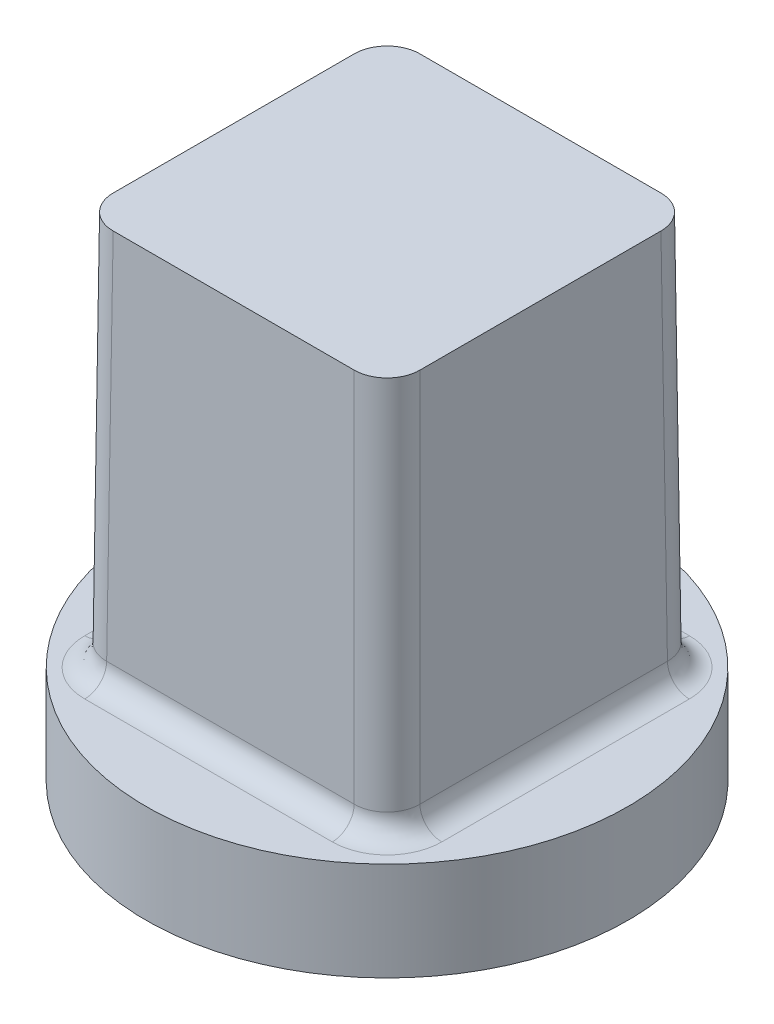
SolidWorks part; units mm, degrees
ref_plane "Płaszczyzna przednia" through (0, 0, 0) normal (0, 0, 1) x (1, 0, 0)
ref_plane "Płaszczyzna górna" through (0, 0, 0) normal (0, 1, 0) x (1, 0, 0)
ref_plane "Płaszczyzna prawa" through (0, 0, 0) normal (1, 0, 0) x (0, 0, -1)
imported_body "Import3"
ref_plane "Płaszczyzna1" through (0, 1.5, 0) normal (0, 1, 0) x (1, 0, 0)
sketch "Szkic1" plane through (0, 1.5, 0) normal (0, 1, 0) x (1, 0, 0)
  circle A0 centre (0, 0) radius 11
extrude "Dodanie-wyciągnięcie1" add sketch "Szkic1" against normal blind 4.5
sketch "Szkic2" plane through (0, -3, 0) normal (0, -1, 0) x (1, 0, 0)
  line L0 (2.1765, -9.2473) -> (0.7416, -5.1468)
  line L1 (0.7416, -5.1468) -> (2.6294, -4.4863)
  line L2 (2.6294, -4.4863) -> (4.0643, -8.5867)
  arc A0 (4.0643, -8.5867) -> (2.1765, -9.2473) centre (0, 0) ccw
draft "Pochylenie1" type of draft neutral plane draft angle 0.5 faces to draft 1 parameters "D1"=0.5
ref_plane "Płaszczyzna2" through (0, 0, 7.0698) normal (0, 0, 1) x (1, 0, 0)
ref_plane "Płaszczyzna3" through (0, 0, -7.0698) normal (0, 0, -1) x (-1, 0, 0)
fillet "Zaokrąglenie1" radius 1.5 4 edges at (-7.0785, 10.5, -7.0785) (-7.0785, 10.5, 7.0785) (7.0785, 10.5, 7.0785) (7.0785, 10.5, -7.0785)
fillet "Zaokrąglenie2" radius 1 8 edges at (6.7178, 1.5, 6.7178) (0, 1.5, 7.1571) (7.1571, 1.5, 0) (-6.7178, 1.5, 6.7178) (6.7178, 1.5, -6.7178) (-7.1571, 1.5, 0) (0, 1.5, -7.1571) (-6.7178, 1.5, -6.7178)
sketch "Szkic9" plane through (0, 2, 0) normal (0, 1, 0) x (1, 0, 0)
  line L0 (-5.1527, 4.9757) -> (-5.1527, -4.9757) construction
  line L1 (-4.9757, -5.1527) -> (4.9757, -5.1527) construction
  line L2 (5.1527, -4.9757) -> (5.1527, 4.9757) construction
  line L3 (4.9757, 5.1527) -> (-4.9757, 5.1527) construction
  line L12 (-5.1527, 4.9757) -> (-5.1527, -4.9757)
  line L13 (-4.9757, -5.1527) -> (4.9757, -5.1527)
  line L14 (5.1527, -4.9757) -> (5.1527, 4.9757)
  line L15 (4.9757, 5.1527) -> (-4.9757, 5.1527)
  ellipse E0 centre (-3.6526, 3.6526) end of major axis (-5.067, 5.067) minor radius 2 (-4.9757, 5.1527) -> (-5.1527, 4.9757) ccw construction
  ellipse E1 centre (-3.6526, -3.6526) end of major axis (-5.067, -5.067) minor radius 2 (-5.1527, -4.9757) -> (-4.9757, -5.1527) ccw construction
  ellipse E2 centre (3.6526, -3.6526) end of major axis (5.067, -5.067) minor radius 2 (4.9757, -5.1527) -> (5.1527, -4.9757) ccw construction
  ellipse E3 centre (3.6526, 3.6526) end of major axis (5.067, 5.067) minor radius 2 (5.1527, 4.9757) -> (4.9757, 5.1527) ccw construction
  ellipse E4 centre (-3.6526, 3.6526) end of major axis (-5.067, 5.067) minor radius 2 (-4.9757, 5.1527) -> (-5.1527, 4.9757) ccw
  ellipse E5 centre (-3.6526, -3.6526) end of major axis (-5.067, -5.067) minor radius 2 (-5.1527, -4.9757) -> (-4.9757, -5.1527) ccw
  ellipse E6 centre (3.6526, -3.6526) end of major axis (5.067, -5.067) minor radius 2 (4.9757, -5.1527) -> (5.1527, -4.9757) ccw
  ellipse E7 centre (3.6526, 3.6526) end of major axis (5.067, 5.067) minor radius 2 (5.1527, 4.9757) -> (4.9757, 5.1527) ccw
extrude "Dodanie-wyciągnięcie2" add sketch "Szkic9" along normal up to surface (17.5 mm away)
